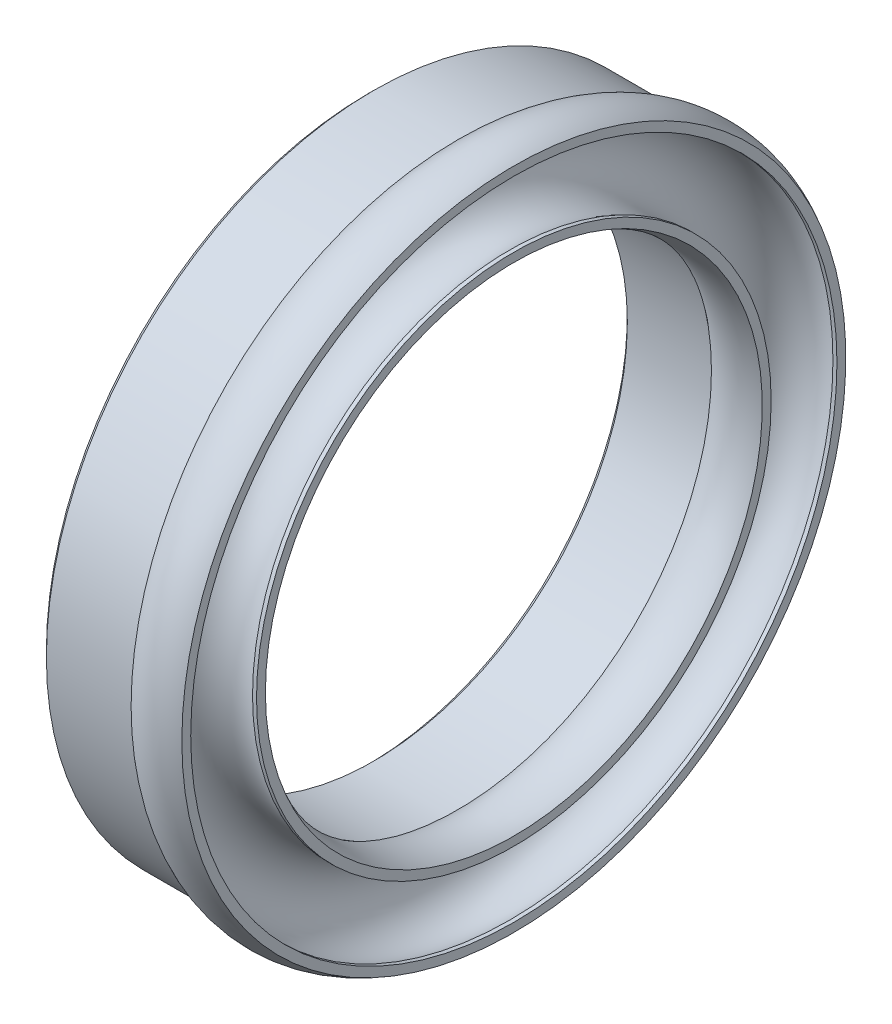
SolidWorks part; units mm, degrees
ref_plane "Plane1" through (0, 0, 0) normal (0, 0, 1) x (1, 0, 0)
ref_plane "Plane2" through (0, 0, 0) normal (0, 1, 0) x (1, 0, 0)
ref_plane "Plane3" through (0, 0, 0) normal (1, 0, 0) x (0, 0, -1)
sketch "Sketch1" plane through (0, 0, 0) normal (0, 0, 1) x (1, 0, 0)
  line L0 (2.9381, 8.3229) -> (0.1778, 8.3229)
  line L1 (0, 8.5007) -> (0, 10.5667)
  line L2 (0.1778, 10.7445) -> (2.9586, 10.7445)
  line L3 (0, 8.5007) -> (0.1778, 8.3229)
  line L4 (0, 10.5667) -> (0.1778, 10.7445)
  line L5 (0, 0) -> (53.34, 0) construction
  line L6 (4.7752, 8.1539) -> (4.7752, 8.4455)
  line L7 (4.7752, 10.6045) -> (4.644, 10.6045)
  line L8 (4.7752, 8.4455) -> (4.644, 8.4455)
  line L9 (4.7752, 10.6045) -> (4.7752, 10.8961)
  arc A0 (4.644, 10.6045) -> (4.644, 8.4455) centre (3.975, 9.525) ccw
  arc A1 (4.7752, 10.8961) -> (2.9586, 10.7445) centre (3.975, 9.525) ccw
  arc A2 (2.9381, 8.3229) -> (4.7752, 8.1539) centre (3.975, 9.525) ccw
  dimension "D4" = 3.175
  dimension "D5" = 0.1778
  dimension "D6" = 1.27
  dimension "D1" = 9.525
  dimension "D2" = 45
  dimension "D3" = 1.0795
  dimension "D7" = 1.0795
  dimension "D8" = 4.7752
revolve "Base-Revolve" add sketch "Sketch1" angle 360 about L5
